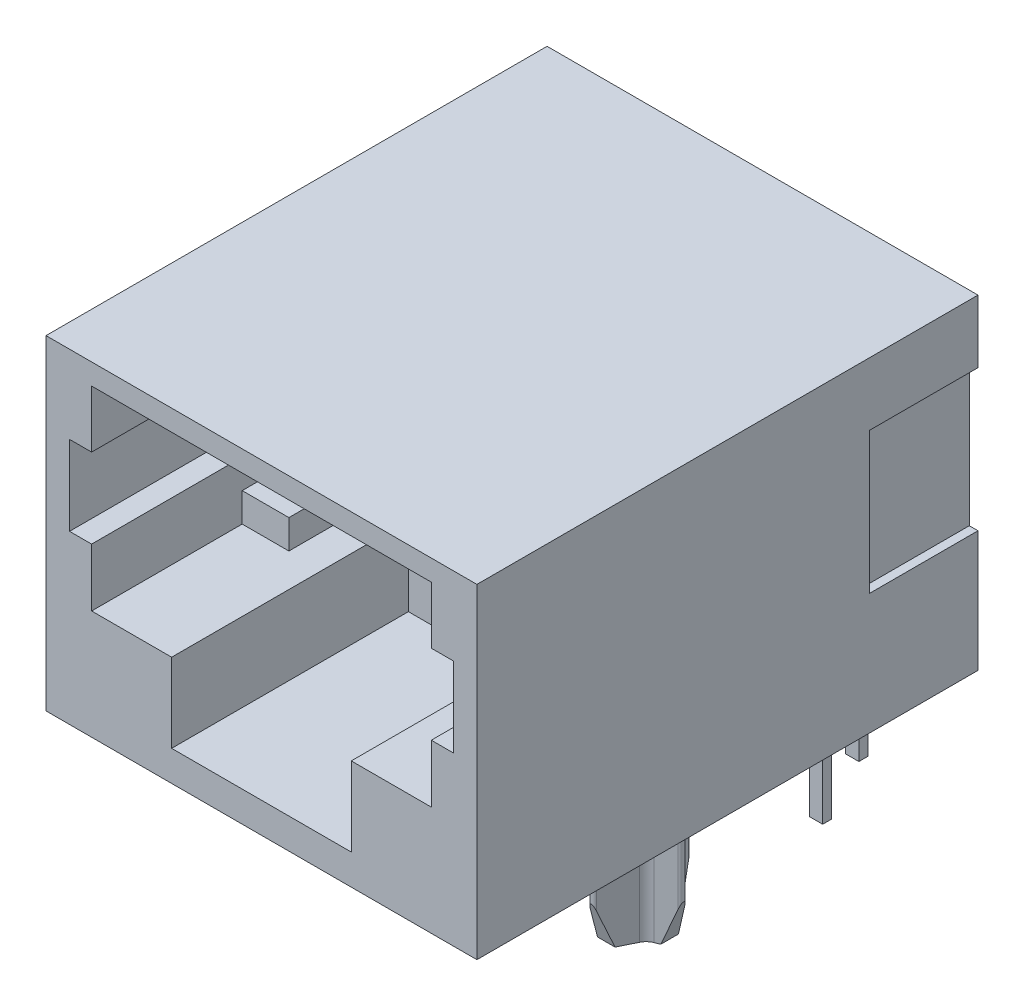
SolidWorks part; units mm, degrees
ref_plane "Front" through (0, 0, 0) normal (0, 0, 1) x (1, 0, 0)
ref_plane "Top" through (0, 0, 0) normal (0, 1, 0) x (1, 0, 0)
ref_plane "Right" through (0, 0, 0) normal (1, 0, 0) x (0, 0, -1)
imported_body "Импортированный1"
sketch "Эскиз1" plane through (0, 0, 3) normal (0, 0, 1) x (1, 0, 0)
  line L0 (7.5565, 13.1318) -> (7.5565, 0.381) construction
  line L1 (-7.5565, 0.381) -> (7.5565, 0.381)
  line L2 (-7.5565, 0.381) -> (-7.5565, 13.3858)
  line L3 (-7.5565, 13.3858) -> (7.5565, 13.3858)
  line L4 (7.5565, 0.381) -> (7.5565, 13.3858)
  line L5 (-7.3025, 13.3858) -> (7.3025, 13.3858) construction
extrude "Вытянуть1" cut sketch "Эскиз1" against normal blind 3
sketch "Эскиз2" plane through (0, 13.3858, 0) normal (0, 1, 0) x (-1, 0, 0)
  line L0 (7.5565, -17.574) -> (-7.5565, -17.574) construction
  line L1 (7.5565, 0) -> (-7.5565, 0)
  line L2 (7.5565, 0) -> (7.5565, -17.574)
  line L3 (7.5565, -17.574) -> (-7.5565, -17.574)
  line L4 (-7.5565, 0) -> (-7.5565, -17.574)
  line L5 (-7.3025, 0) -> (7.3025, 0) construction
  line L6 (7.5565, -13.764) -> (7.5565, 0) construction
  line L7 (-7.5565, 0) -> (-7.5565, -13.764) construction
extrude "Вытянуть2" cut sketch "Эскиз2" against normal offset from surface (1.9858 mm away) 11.4
sketch "Эскиз3" plane through (0, 0, -8.303) normal (0, 0, 1) x (1, 0, 0)
  line L1 (-4.318, 4.8514) -> (4.337, 4.8514)
  line L2 (-4.318, 4.8514) -> (-4.318, 7.366)
  line L3 (-4.318, 7.366) -> (4.337, 7.366)
  line L4 (4.337, 4.8514) -> (4.337, 7.366)
extrude "Вытянуть3" cut sketch "Эскиз3" along normal blind 1
sketch "Эскиз5" plane through (0, 0, 0) normal (0, 1, 0) x (1, 0, 0)
  line L0 (-6.3565, 17.574) -> (-6.3565, 14.574)
  line L1 (-7.5565, 0) -> (7.5565, 0)
  line L2 (-7.5565, 0) -> (-7.5565, 17.574)
  line L3 (-7.5565, 17.574) -> (-6.3565, 17.574)
  line L4 (7.5565, 0) -> (7.5565, 17.574)
  line L5 (-6.3565, 14.574) -> (-4.9565, 14.574)
  line L6 (-4.9565, 14.574) -> (-4.9565, 12.774)
  line L7 (-4.9565, 12.774) -> (6.2565, 12.774)
  line L8 (6.2565, 12.774) -> (6.2565, 17.574)
  line L9 (6.2565, 17.574) -> (7.5565, 17.574)
  dimension "D1" = 1.2
  dimension "D2" = 3
  dimension "D3" = 2.6
  dimension "D4" = 4.8
  dimension "D5" = 1.3
extrude "Вытянуть4" add sketch "Эскиз5" along normal up to surface (1.0668 mm away)
